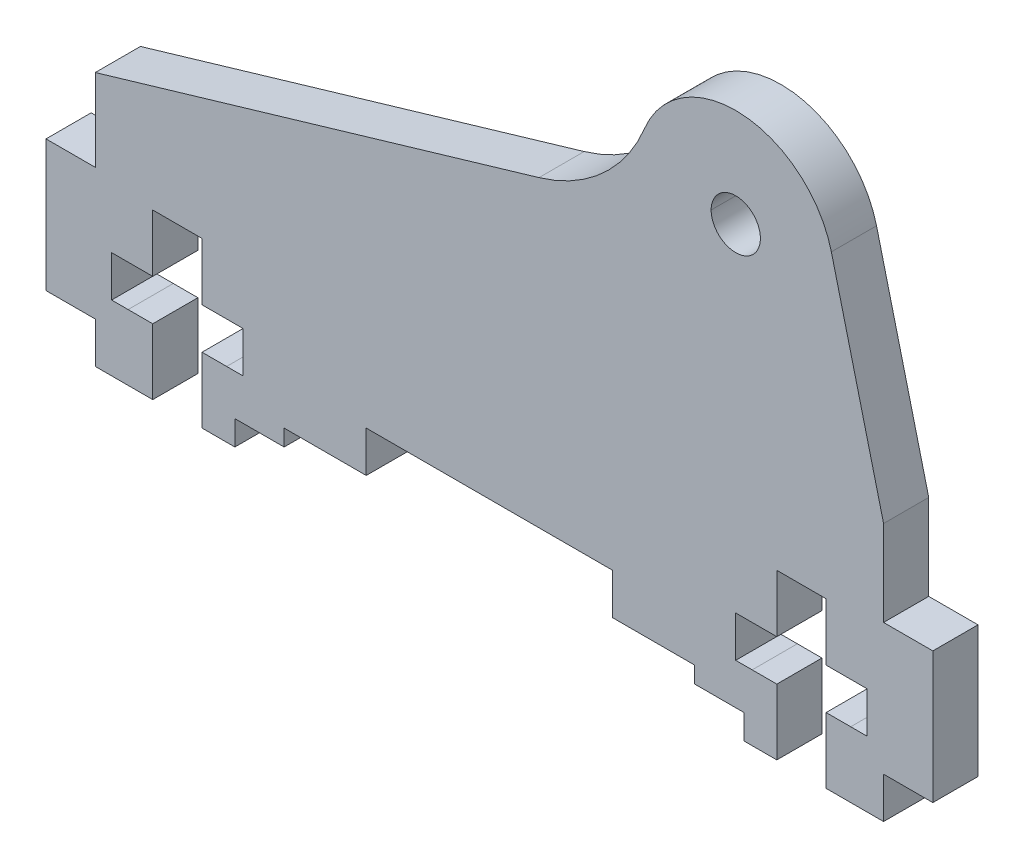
SolidWorks part; units mm, degrees
ref_plane "Front Plane" through (0, 0, 0) normal (0, 0, 1) x (1, 0, 0)
ref_plane "Top Plane" through (0, 0, 0) normal (0, 1, 0) x (1, 0, 0)
ref_plane "Right Plane" through (0, 0, 0) normal (1, 0, 0) x (0, 0, -1)
imported_body "Imported1"
sketch "Sketch1" plane through (0, 0, 0) normal (0, 0, 1) x (1, 0, 0)
  line L0 (220.9243, 32.81) -> (220.9243, 42.81) construction
  line L1 (166.9243, 42.81) -> (169.9243, 42.81)
  line L2 (166.9243, 42.81) -> (166.9243, 41.81)
  line L3 (166.9243, 41.81) -> (169.9243, 41.81)
  line L4 (169.9243, 42.81) -> (169.9243, 41.81)
  line L5 (166.9243, 32.81) -> (169.9243, 32.81)
  line L6 (166.9243, 32.81) -> (166.9243, 33.81)
  line L7 (166.9243, 33.81) -> (169.9243, 33.81)
  line L8 (169.9243, 32.81) -> (169.9243, 33.81)
  line L9 (217.9243, 32.81) -> (220.9243, 32.81)
  line L10 (217.9243, 32.81) -> (217.9243, 33.81)
  line L11 (217.9243, 33.81) -> (220.9243, 33.81)
  line L12 (220.9243, 32.81) -> (220.9243, 33.81)
  line L14 (220.9243, 42.81) -> (217.9243, 42.81)
  line L15 (220.9243, 42.81) -> (220.9243, 41.81)
  line L16 (220.9243, 41.81) -> (217.9243, 41.81)
  line L17 (217.9243, 42.81) -> (217.9243, 41.81)
extrude "Cut-Extrude1" cut sketch "Sketch1" along normal blind 3
sketch "Sketch2" plane through (0, 0, 0) normal (1, 0, 0) x (0, 0, -1)
  line L0 (-3, 31.31) -> (0, 31.31) construction
  line L1 (-3, 64.31) -> (-2.75, 64.31)
  line L2 (-3, 64.31) -> (-3, 31.31)
  line L3 (-3, 31.31) -> (-2.75, 31.31)
  line L4 (-2.75, 64.31) -> (-2.75, 31.31)
extrude "Cut-Extrude2" cut sketch "Sketch2" along normal blind 270
sketch "Sketch3" plane through (0, 0, 0) normal (0, 0, 1) x (1, 0, 0)
  line L1 (170.92, 37.81) -> (178.92, 37.81)
  line L2 (170.92, 37.81) -> (170.92, 35.31)
  line L3 (170.92, 35.31) -> (178.92, 35.31)
  line L4 (178.92, 37.81) -> (178.92, 35.31)
  line L5 (208.92, 37.81) -> (216.92, 37.81)
  line L6 (208.92, 37.81) -> (208.92, 35.31)
  line L7 (208.92, 35.31) -> (216.92, 35.31)
  line L8 (216.92, 37.81) -> (216.92, 35.31)
extrude "Cut-Extrude3" cut sketch "Sketch3" along normal blind 3
